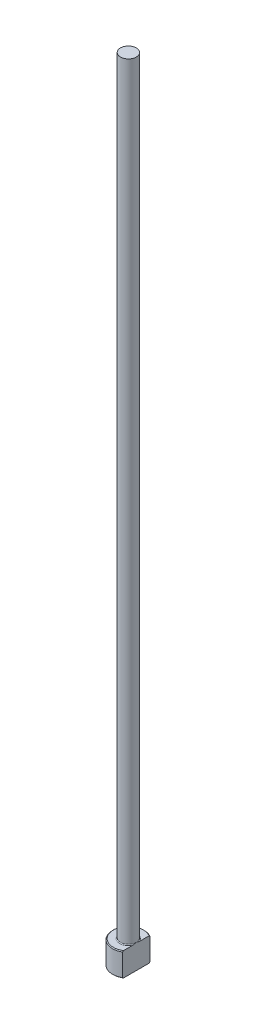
SolidWorks part; units mm, degrees
ref_plane "Front Plane" through (0, 0, 0) normal (0, 0, 1) x (1, 0, 0)
ref_plane "Top Plane" through (0, 0, 0) normal (0, 1, 0) x (1, 0, 0)
ref_plane "Right Plane" through (0, 0, 0) normal (1, 0, 0) x (0, 0, -1)
sketch "Sketch1" plane through (0, 0, 0) normal (0, 0, 1) x (1, 0, 0)
  line L0 (0, 259.9588) -> (0, -15.1925) construction
  line L1 (0, 0) -> (-4, 0)
  line L2 (-4, 0) -> (-4, 6)
  line L3 (-4, 6) -> (-2, 6)
  line L4 (-2, 6) -> (-2, 200)
  line L5 (-2, 200) -> (0, 200)
  line L6 (0, 200) -> (0, 0)
  dimension "L" = 200
  dimension "H" = 8
  dimension "T" = 6
  dimension "D" = 4
revolve "Revolve1" add sketch "Sketch1" angle 360 about L0
chamfer "Chamfer1" distance 0.2 angle 45 2 edges at (0, 6, 4) (0, 0, 4)
fillet "Fillet1" radius 0.2 1 edges at (0, 6, 2)
sketch "Sketch2" plane through (0, 0, 0) normal (0, 1, 0) x (1, 0, 0)
  line L0 (2, -3.4641) -> (2, 3.4641)
  circle A0 centre (0, 0) radius 4 construction
  arc A1 (2, -3.4641) -> (2, 3.4641) centre (0, 0) ccw
  circle A2 centre (0, 0) radius 2 construction
extrude "KEYED HEAD" cut sketch "Sketch2" along normal through all
